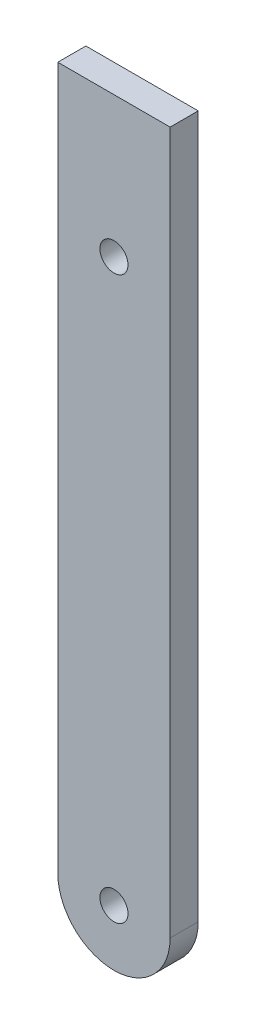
SolidWorks part; units mm, degrees
ref_plane "Front Plane" through (0, 0, 0) normal (0, 0, 1) x (1, 0, 0)
ref_plane "Top Plane" through (0, 0, 0) normal (0, 1, 0) x (1, 0, 0)
ref_plane "Right Plane" through (0, 0, 0) normal (1, 0, 0) x (0, 0, -1)
sketch "Sketch1" plane through (0, 0, 0) normal (0, 0, 1) x (1, 0, 0)
  line L0 (-10, 0) -> (-10, 125)
  line L1 (-10, 125) -> (10, 125)
  line L2 (10, 125) -> (10, 0)
  line L3 (0, 0) -> (0, 100) construction
  circle A0 centre (0, 0) radius 10 construction
  arc A1 (-10, 0) -> (10, 0) centre (0, 0) ccw
  circle A2 centre (0, 0) radius 2.5
  circle A3 centre (0, 100) radius 2.5
  dimension "D1" = 20
  dimension "D3" = 5
  dimension "D5" = 5
  dimension "D2" = 125
  dimension "D4" = 100
extrude "Boss-Extrude1" add sketch "Sketch1" along normal blind 5
